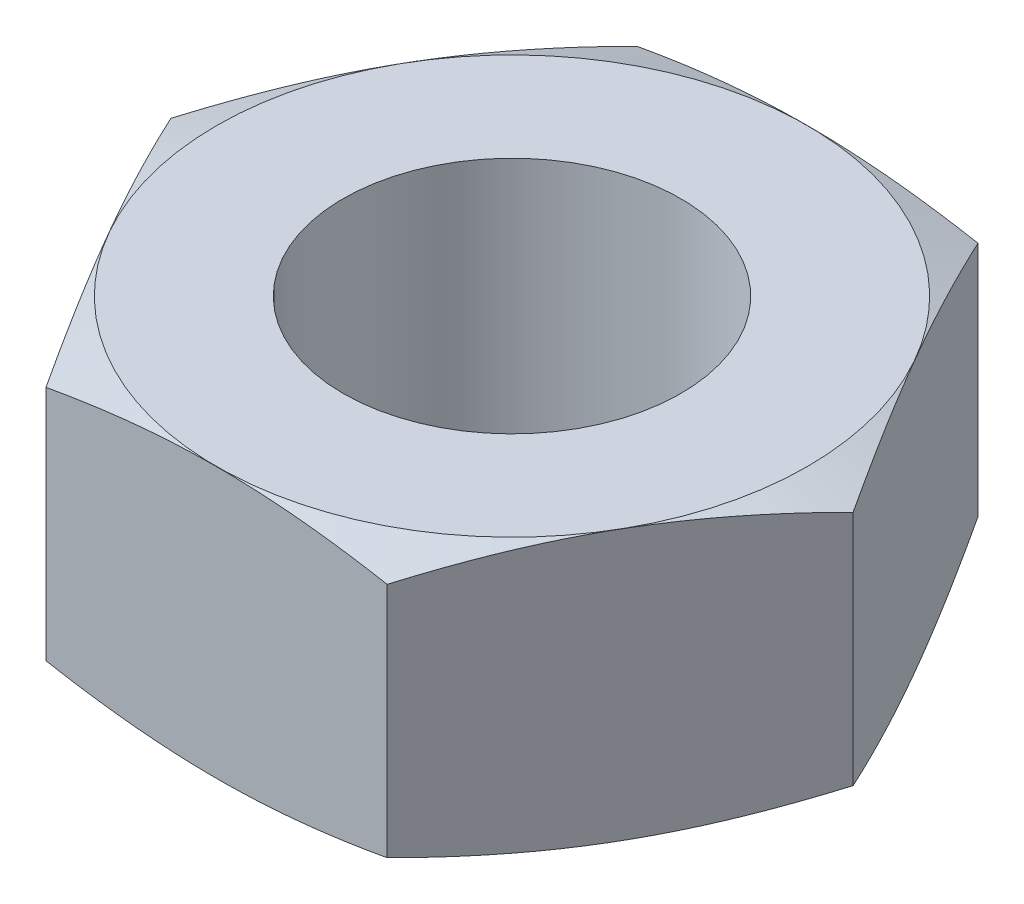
SolidWorks part; units mm, degrees
ref_plane "前视基准面" through (0, 0, 0) normal (0, 0, 1) x (1, 0, 0)
ref_plane "上视基准面" through (0, 0, 0) normal (0, 1, 0) x (1, 0, 0)
ref_plane "右视基准面" through (0, 0, 0) normal (1, 0, 0) x (0, 0, -1)
sketch "Sketch2" plane through (0, 0, 0) normal (0, 1, 0) x (1, 0, 0)
  line L1 (4.0415, 0) -> (2.0207, 3.5)
  line L2 (2.0207, 3.5) -> (-2.0207, 3.5)
  line L3 (-2.0207, 3.5) -> (-4.0415, 0)
  line L4 (-4.0415, 0) -> (-2.0207, -3.5)
  line L5 (-2.0207, -3.5) -> (2.0207, -3.5)
  line L6 (2.0207, -3.5) -> (4.0415, 0)
  circle A0 centre (0, 0) radius 3.5 construction
  circle A1 centre (0, 0) radius 2
  dimension "公称直径" = 4
  dimension "对边距离" = 7
extrude "Boss-Extrude1" add sketch "Sketch2" along normal mid plane 3.2
sketch "Sketch3" plane through (0, 0, 0) normal (0, 0, 1) x (1, 0, 0)
  line L0 (0, 0) -> (-4.0415, 0) construction
  line L1 (-4.0415, 1.6) -> (-4.0415, -1.6) construction
  line L2 (-4.0415, 1.6) -> (-3.499, 1.6)
  line L3 (-4.0415, 1.6) -> (-2.0207, 1.6) construction
  line L4 (-3.499, 1.6) -> (-4.0415, 1.4025)
  line L5 (-4.0415, 1.4025) -> (-4.0415, 1.6)
  line L6 (0, 0) -> (0, 1.6) construction
  line L7 (-2.0207, 1.6) -> (2.0207, 1.6) construction
  line L8 (-3.499, -1.6) -> (-4.0415, -1.4025)
  line L9 (-4.0415, -1.4025) -> (-4.0415, -1.6)
  line L10 (-4.0415, -1.6) -> (-3.499, -1.6)
  dimension "切除角" = 20
  dimension "切除距离" = 0.5425
revolve "Cut-Revolve1" cut sketch "Sketch3" angle 360 about L6
other "冻结***"
